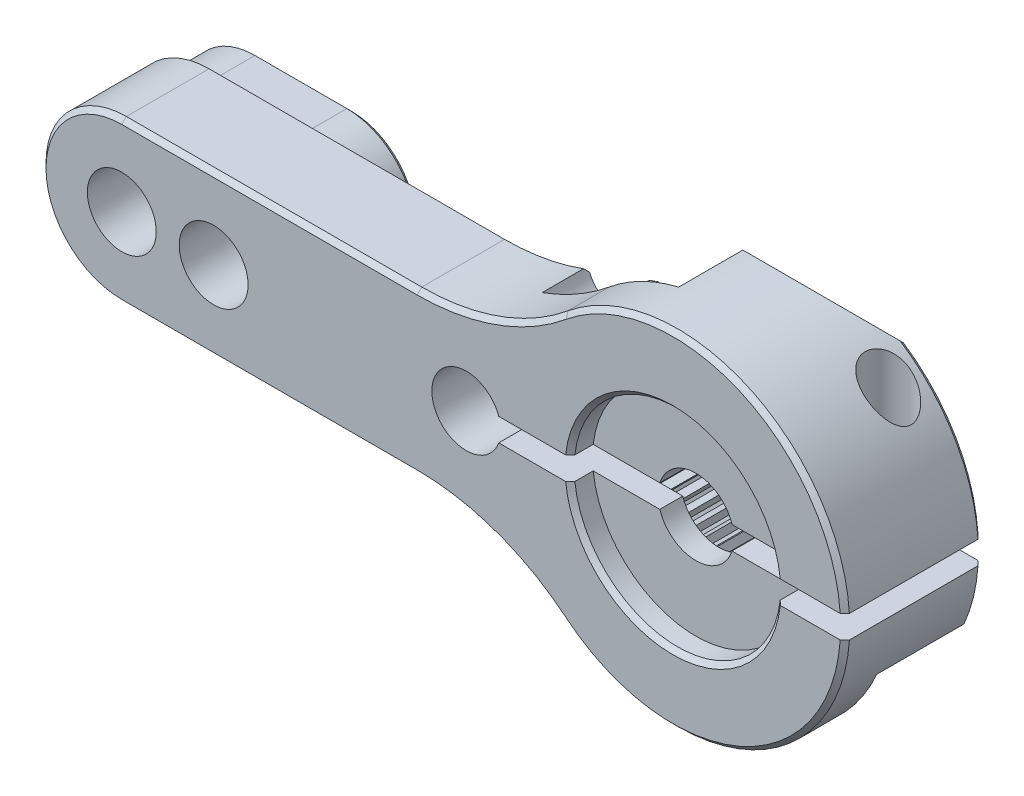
SolidWorks part; units mm, degrees
ref_plane "Plan de face" through (0, 0, 0) normal (0, 0, 1) x (1, 0, 0)
ref_plane "Plan de dessus" through (0, 0, 0) normal (0, 1, 0) x (1, 0, 0)
ref_plane "Plan de droite" through (0, 0, 0) normal (1, 0, 0) x (0, 0, -1)
sketch "Esquisse1" plane through (0, 0, 0) normal (0, 0, 1) x (1, 0, 0)
  line L0 (-11.1355, 3.5) -> (-24, 3.5)
  line L1 (-24, -3.5) -> (-11.1355, -3.5)
  line L2 (0, 0) -> (-40.4273, 0) construction
  line L3 (-27.5, 8.0474) -> (-27.5, -5.9021) construction
  line L4 (7.5, 11.0169) -> (7.5, -8.8025) construction
  circle A1 centre (0, 0) radius 1.65
  arc A2 (-4.7724, 5.7857) -> (-4.7724, -5.7857) centre (0, 0) cw
  arc A3 (-24, 3.5) -> (-24, -3.5) centre (-24, 0) ccw
  arc A4 (-11.1355, -3.5) -> (-4.7724, -5.7857) centre (-11.1355, -13.5) cw
  arc A5 (-4.7724, 5.7857) -> (-11.1355, 3.5) centre (-11.1355, 13.5) cw
  circle A6 centre (-9, 0) radius 1.5
  circle A7 centre (-24, 0) radius 1.5
  circle A8 centre (-20, 0) radius 1.5
  point P14 (-6.6332, -3.5)
  point P18 (-6.6332, 3.5)
  dimension "D1" = 7.5
  dimension "D2" = 3.3
  dimension "D5" = 10
  dimension "D6" = 3
  dimension "D7" = 3
  dimension "D8" = 3
  dimension "D3" = 7
  dimension "D4" = 35
  dimension "D9" = 9
  dimension "D10" = 11
  dimension "D11" = 4
extrude "Boss.-Extru.1" add sketch "Esquisse1" along normal blind 6
sketch "Esquisse2" plane through (0, 0, 6) normal (0, 0, 1) x (1, 0, 0)
  line L0 (7.5, 0) -> (-41.9387, 0) construction
  line L1 (8.5, 0.5) -> (-10.4142, 0.5)
  line L2 (8.5, 0.5) -> (8.5, -0.5)
  line L3 (8.5, -0.5) -> (-10.4142, -0.5)
  line L4 (-10.4142, 0.5) -> (-10.4142, -0.5)
  arc A0 (-4.7724, -5.7857) -> (-4.7724, 5.7857) centre (0, 0) ccw construction
  circle A1 centre (-9, 0) radius 1.5 construction
  dimension "D1" = 1
  dimension "D2" = 1
extrude "Enlèv. mat.-Extru.1" cut sketch "Esquisse2" against normal blind 6
sketch "Esquisse3" plane through (0, 0, 0) normal (0, 0, -1) x (-1, 0, 0)
  line L2 (24, -3.5) -> (11.1355, -3.5)
  line L3 (24, -3.5) -> (11.1355, -3.5)
  line L5 (24, 0) -> (20, 0) construction
  line L6 (11.1355, 3.5) -> (24, 3.5)
  line L7 (11.1355, 3.5) -> (24, 3.5)
  line L8 (24, -3) -> (20, -3)
  line L9 (24, 3) -> (20, 3)
  arc A0 (4.7724, 5.7857) -> (4.7724, -5.7857) centre (0, 0) cw
  arc A5 (11.1355, -3.5) -> (4.7724, -5.7857) centre (11.1355, -13.5) ccw
  arc A6 (11.1355, -3.5) -> (4.7724, -5.7857) centre (11.1355, -13.5) ccw
  arc A10 (24, -3) -> (24, 3) centre (24, 0) ccw
  arc A11 (20, 3) -> (20, -3) centre (20, 0) ccw
  arc A12 (24, -3.5) -> (24, 3.5) centre (24, 0) ccw
  arc A13 (4.7724, 5.7857) -> (11.1355, 3.5) centre (11.1355, 13.5) ccw
  arc A14 (24, -3.5) -> (24, 3.5) centre (24, 0) ccw
  arc A15 (4.7724, 5.7857) -> (11.1355, 3.5) centre (11.1355, 13.5) ccw
  point P5 (22, 0)
  dimension "D3" = 4
  dimension "D4" = 0.5
  dimension "D1" = 0
  dimension "D2" = 0
extrude "Enlèv. mat.-Extru.2" cut sketch "Esquisse3" against normal blind 2
sketch "Esquisse4" plane through (0, 0, 0) normal (0, 0, -1) x (-1, 0, 0)
  line L0 (-7.5, -3) -> (-3.25, -3)
  line L1 (-1.75, -4.5) -> (-1.75, -7.5)
  line L2 (-1.75, -7.5) -> (-7.5, -7.5)
  line L3 (-7.5, -7.5) -> (-7.5, -3)
  line L4 (-1.5724, -0.5) -> (-7.4833, -0.5) construction
  line L5 (1.5724, 0.5) -> (7.4833, 0.5) construction
  line L6 (1.75, 7.5) -> (7.75, 7.5)
  line L7 (1.75, 7.5) -> (1.75, 4.5)
  line L8 (3.25, 3) -> (6.25, 3)
  line L9 (7.75, 7.5) -> (7.75, 4.5)
  arc A0 (7.4833, 0.5) -> (-7.4833, 0.5) centre (0, 0) ccw construction
  arc A1 (-7.4833, -0.5) -> (7.4833, -0.5) centre (0, 0) ccw construction
  arc A2 (-3.25, -3) -> (-1.75, -4.5) centre (-3.25, -4.5) cw
  arc A3 (6.25, 3) -> (7.75, 4.5) centre (6.25, 4.5) ccw
  arc A4 (1.75, 4.5) -> (3.25, 3) centre (3.25, 4.5) ccw
  point P14 (-1.75, -3)
  dimension "D3" = 1.5
  dimension "D7" = 1.5
  dimension "D1" = 5.75
  dimension "D2" = 2.5
  dimension "D4" = 3.5
  dimension "D5" = 2.5
  dimension "D6" = 6
extrude "Enlèv. mat.-Extru.3" cut sketch "Esquisse4" against normal blind 4
sketch "Esquisse5" plane through (0, -3, 0) normal (0, -1, 0) x (1, 0, 0)
  line L0 (3.25, 4) -> (6.8739, 4) construction
  line L2 (6.8739, 4) -> (6.8739, 0) construction
  circle A0 centre (4.8739, 1.5) radius 1
  dimension "D1" = 2
  dimension "D2" = 2.5
  dimension "D3" = 2
extrude "Enlèv. mat.-Extru.4" cut sketch "Esquisse5" against normal through all
sketch "Esquisse6" plane through (0, 3, 0) normal (0, 1, 0) x (1, 0, 0)
  line L0 (-7.4833, -2) -> (-7.4833, 0) construction
  line L1 (4.8739, -1.5) -> (-10.9129, -1.5) construction
  circle A0 centre (-5.2333, -1.5) radius 1
  dimension "D1" = 2
  dimension "D2" = 2.25
extrude "Enlèv. mat.-Extru.5" cut sketch "Esquisse6" against normal through all
sketch "Esquisse7" plane through (0, 0, 0) normal (1, 0, 0) x (0, 0, -1)
  line L0 (-1.4142, 7.5) -> (0, 6.0858)
  line L1 (0, 7.5) -> (-6, 7.5) construction
  line L2 (0, 0.5) -> (0, 7.5) construction
  line L3 (0, 6.0858) -> (0, 7.5)
  line L4 (0, 7.5) -> (-1.4142, 7.5)
  line L5 (0, -6.0858) -> (-1.4142, -7.5)
  line L6 (0, -7.293) -> (0, -4.5) construction
  line L7 (-1.4142, -7.5) -> (0, -7.5)
  line L8 (0, -7.5) -> (0, -6.0858)
  line L9 (0, -7.5) -> (0, -0.5) construction
  dimension "D1" = 2
  dimension "D2" = 45
  dimension "D3" = 45
  dimension "D4" = 2
  dimension "D5" = 15
extrude "Enlèv. mat.-Extru.6" cut sketch "Esquisse7" against normal blind 10 and the other way blind 10
sketch "Esquisse8" plane through (0, 0, 0) normal (0, 0, -1) x (-1, 0, 0)
  circle A0 centre (0, 0) radius 3
  dimension "D1" = 6
extrude "Enlèv. mat.-Extru.7" cut sketch "Esquisse8" against normal blind 4
sketch "Esquisse9" plane through (0, 0, 0) normal (0, 0, -1) x (-1, 0, 0)
  line L0 (0, 0) -> (0, 3.5855) construction
  line L1 (-0.8887, 3) -> (1.1976, 3) construction
  line L2 (-0.2021, 3) -> (0, 2.65)
  line L3 (0, 2.65) -> (0.2021, 3)
  line L4 (0.2021, 3) -> (-0.2021, 3)
  arc A0 (2.958, 0.5) -> (-2.958, 0.5) centre (0, 0) ccw construction
  dimension "D1" = 30
  dimension "D2" = 0.35
extrude "Boss.-Extru.2" add sketch "Esquisse9" against normal up to surface (4 mm away)
pattern_circular "Répétition circulaire1" count 36 over 360 about axis through (0, 0, 0) along (0, 0, 1) of "Boss.-Extru.2"
sketch "Esquisse10" plane through (0, 0, 0) normal (0, 0, -1) x (-1, 0, 0)
  line L0 (7.4833, -0.5) -> (2.9581, -0.5) construction
  line L1 (-7.4833, 0.5) -> (3.8917, 0.5)
  line L2 (-7.4833, 0.5) -> (-7.4833, -0.5)
  line L3 (-7.4833, -0.5) -> (3.8917, -0.5)
  line L4 (3.8917, 0.5) -> (3.8917, -0.5)
extrude "Enlèv. mat.-Extru.8" cut sketch "Esquisse10" against normal through all
chamfer "Chanfrein1" distance 0.2 angle 45 22 edges at (-22, 3, 0) (-7.2716, 1.8368, 0) (7.2866, -1.7763, 0) (-7.7549, -4.0888, 6) (2.9702, -6.8868, 6) (-8.5271, -3.8462, 2) (-5.6206, -5.1582, 2.422) (-7.7549, 4.0888, 6) (-17.5678, 3.5, 6) (6.5578, 3.6395, 0) (2.9702, 6.8868, 6) (-27.5, 0, 6) (-6.5578, -3.6395, 0) (-17.5678, -3.5, 6) (-9.3901, 3.6535, 2) (-17.5678, 3.5, 2) (-27.5, 0, 2) (-17.5678, -3.5, 2) (-27, 0, 0) (-17, 0, 0)
sketch "Esquisse11" plane through (0, 0, 6) normal (0, 0, 1) x (1, 0, 0)
  circle A0 centre (0, 0) radius 4.5
  dimension "D1" = 9
extrude "Enlèv. mat.-Extru.9" cut sketch "Esquisse11" against normal blind 1
chamfer "Chanfrein2" distance 0.2 angle 45 2 edges at (0, -4.5, 6) (0, 4.5, 6)
